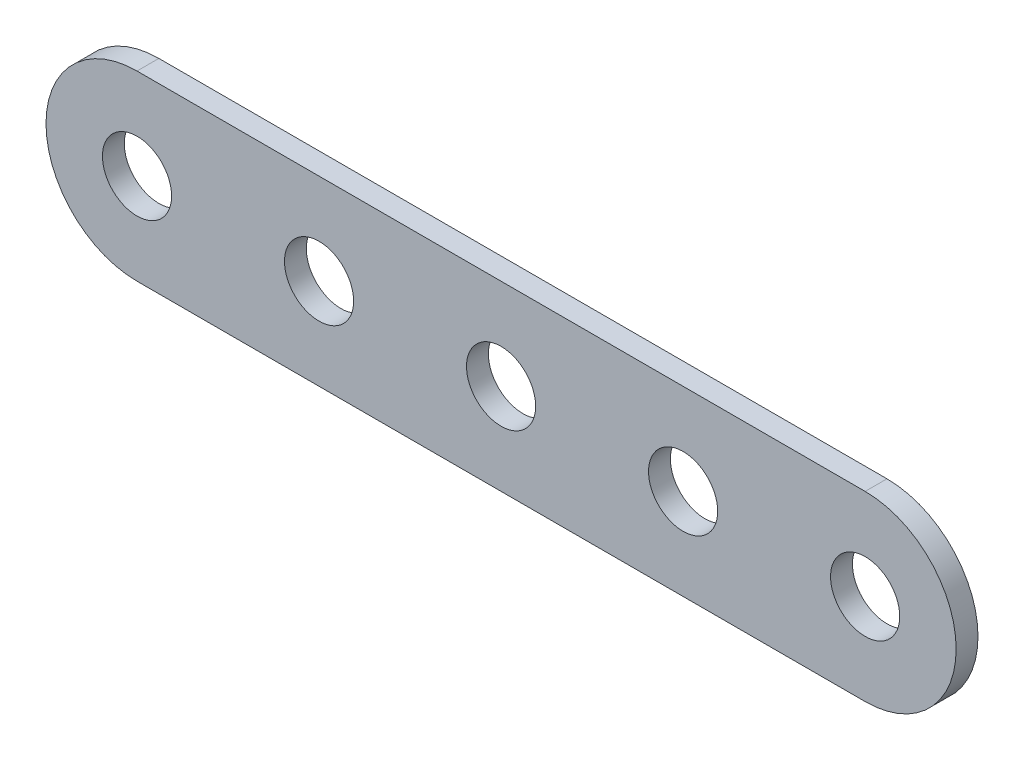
SolidWorks part; units mm, degrees
ref_plane "Front Plane" through (0, 0, 0) normal (0, 0, 1) x (1, 0, 0)
ref_plane "Top Plane" through (0, 0, 0) normal (0, 1, 0) x (1, 0, 0)
ref_plane "Right Plane" through (0, 0, 0) normal (1, 0, 0) x (0, 0, -1)
other "Configuration Table"
sketch "Sketch1" plane through (0, 0, 0) normal (0, 0, 1) x (1, 0, 0)
  line L0 (-25.4, 0) -> (25.4, 0) construction
  line L1 (-25.4, -6.35) -> (25.4, -6.35)
  line L3 (-25.4, 6.35) -> (25.4, 6.35)
  arc A0 (25.4, 6.35) -> (25.4, -6.35) centre (25.4, 0) cw
  arc A1 (-25.4, 6.35) -> (-25.4, -6.35) centre (-25.4, 0) ccw
  dimension "D2" = 6.35
  dimension "D1" = 50.8
extrude "Boss-Extrude1" add sketch "Sketch1" along normal blind 1.524
sketch "Sketch2" plane through (0, 0, 1.524) normal (0, 0, 1) x (1, 0, 0)
  circle A0 centre (-25.4, 0) radius 2.413
  dimension "D1" = 4.826
extrude "Cut-Extrude1" cut sketch "Sketch2" against normal through all
pattern_linear "LPattern1" count 9 spacing 12.7 along (1, 0, 0) of "Cut-Extrude1"
